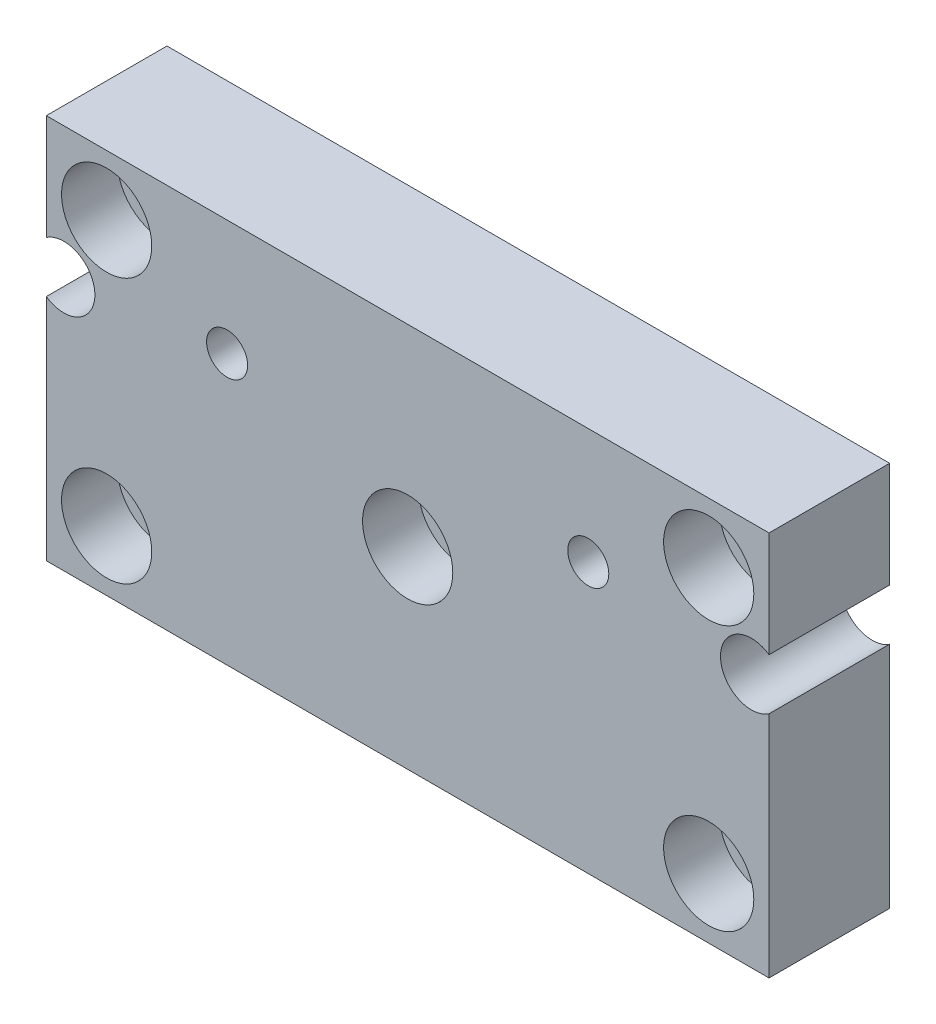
SolidWorks part; units mm, degrees
ref_plane "Front Plane" through (0, 0, 0) normal (0, 0, 1) x (1, 0, 0)
ref_plane "Top Plane" through (0, 0, 0) normal (0, 1, 0) x (1, 0, 0)
ref_plane "Right Plane" through (0, 0, 0) normal (1, 0, 0) x (0, 0, -1)
sketch "Sketch1" plane through (0, 0, 0) normal (0, 0, 1) x (1, 0, 0)
  line L1 (-23.8125, 12.7) -> (23.8125, 12.7)
  line L2 (-23.8125, 12.7) -> (-23.8125, -12.7)
  line L3 (-23.8125, -12.7) -> (23.8125, -12.7)
  line L4 (23.8125, 12.7) -> (23.8125, -12.7)
  dimension "D1" = 25.4
  dimension "D2" = 47.625
  dimension "D3" = 47.625
  dimension "D4" = 23.8125
  dimension "D5" = 12.7
extrude "Extrude1" add sketch "Sketch1" against normal blind 7.9502
sketch "Sketch3" plane through (0, 0, 0) normal (0, 0, 1) x (1, 0, 0)
  circle A0 centre (19.8374, 8.7249) radius 1.778
  circle A1 centre (19.8374, -8.7249) radius 1.778
  circle A2 centre (-19.8374, -8.7249) radius 1.778
  circle A3 centre (-19.8374, 8.7249) radius 1.778
  circle A4 centre (0, 0) radius 1.778
  dimension "D1" = 3.556
  dimension "D2" = 3.556
  dimension "D3" = 3.556
  dimension "D4" = 3.556
  dimension "D10" = 17.4498
  dimension "D11" = 8.7249
  dimension "D12" = 17.4498
  dimension "D13" = 3.556
  dimension "D5" = 19.8374
  dimension "D6" = 19.8374
  dimension "D7" = 19.8374
  dimension "D8" = 19.8374
  dimension "D9" = 8.7249
extrude "Cut-Extrude1" cut sketch "Sketch3" against normal through all
sketch "Sketch4" plane through (0, 0, 0) normal (0, 0, 1) x (1, 0, 0)
  circle A0 centre (19.8374, 8.7249) radius 2.9718
  circle A1 centre (19.8374, -8.7249) radius 2.9718
  circle A2 centre (-19.8374, -8.7249) radius 2.9718
  circle A3 centre (-19.8374, 8.7249) radius 2.9718
  circle A4 centre (0, 0) radius 2.9718
  dimension "D1" = 5.9436
  dimension "D2" = 5.9436
  dimension "D3" = 5.9436
  dimension "D4" = 5.9436
  dimension "D5" = 5.9436
extrude "Cut-Extrude2" cut sketch "Sketch4" against normal blind 3.683
sketch "Sketch5" plane through (0, 0, 0) normal (0, 0, 1) x (1, 0, 0)
  line L0 (23.8125, 12.7) -> (-23.8125, 12.7) construction
  circle A0 centre (22.6568, 4.064) radius 2.0447
  circle A1 centre (-22.6568, 4.064) radius 2.0447
  dimension "D1" = 4.0894
  dimension "D2" = 4.0894
  dimension "D5" = 8.636
  dimension "D6" = 8.636
  dimension "D3" = 22.6568
  dimension "D4" = 22.6568
extrude "Cut-Extrude3" cut sketch "Sketch5" against normal through all
hole_wizard "#6-32 Tapped Hole1" positions "Sketch7" profile "Sketch6" tap size "#6-32" standard "Ansi Inch"
sketch "Sketch7" plane through (0, 0, 0) normal (0, 0, 1) x (1, 0, 0)
  line L0 (-23.8125, -12.7) -> (23.8125, -12.7) construction
  point P0 (-11.8999, 5.08)
  point P1 (11.8999, 5.08)
  dimension "D1" = 17.78
  dimension "D2" = 17.78
  dimension "D3" = 11.8999
  dimension "D4" = 11.8999
sketch "Sketch6" plane through (-11.8999, 5.08, 0) normal (1, 0, 0) x (0, -1, 0)
  line L0 (0, 0) -> (0, 7.9502)
  line L1 (0, 7.9502) -> (1.3525, 7.9502)
  line L2 (1.3525, 7.9502) -> (1.3525, 0)
  line L5 (1.3525, 0) -> (0, 0)
  line L11 (0, -6.35) -> (0, 107.95) construction
  dimension "Thru Tap Drill Dia." = 2.7051
  dimension "Thru Tap Drill Depth" = 7.9502
